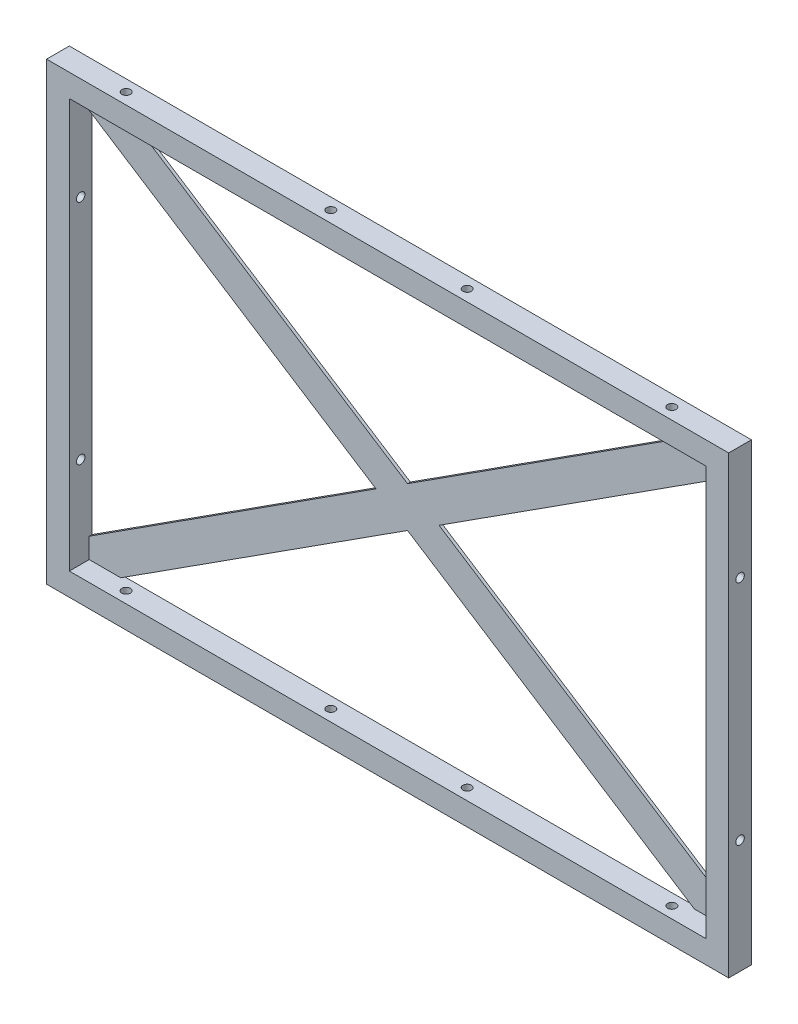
SolidWorks part; units mm, degrees
other "Outer tube"
ref_plane "Front Plane" through (0, 0, 0) normal (0, 0, 1) x (1, 0, 0)
ref_plane "Top Plane" through (0, 0, 0) normal (0, 1, 0) x (1, 0, 0)
ref_plane "Right Plane" through (0, 0, 0) normal (1, 0, 0) x (0, 0, -1)
sketch "Sketch1" plane through (0, 0, 0) normal (0, 0, 1) x (1, 0, 0)
  line L1 (355.6, -228.6) -> (-355.6, -228.6)
  line L2 (355.6, -228.6) -> (355.6, 228.6)
  line L3 (355.6, 228.6) -> (-355.6, 228.6)
  line L4 (-355.6, -228.6) -> (-355.6, 228.6)
  line L5 (355.6, -228.6) -> (-355.6, 228.6) construction
  line L6 (355.6, 228.6) -> (-355.6, -228.6) construction
  line L7 (381, -254) -> (-381, -254)
  line L8 (381, -254) -> (381, 254)
  line L9 (381, 254) -> (-381, 254)
  line L10 (-381, -254) -> (-381, 254)
  line L11 (381, -254) -> (-381, 254) construction
  line L12 (381, 254) -> (-381, -254) construction
  point P0 (0, 0)
  point P6 (0, 0)
  dimension "D1" = 25.4
  dimension "30" = 711.2
  dimension "D2" = 25.4
  dimension "9" = 457.2
extrude "Boss-Extrude1" add sketch "Sketch1" along normal blind 25.4
sketch "Sketch2" plane through (0, 0, 0) normal (0, 0, 1) x (1, 0, 0)
  line L0 (-355.6, 205.9532) -> (320.3716, -228.6)
  line L1 (-355.6, -228.6) -> (-355.6, 228.6) construction
  line L2 (355.6, -228.6) -> (-355.6, -228.6) construction
  line L3 (-320.3716, 228.6) -> (355.6, -205.9532)
  line L4 (355.6, 228.6) -> (-355.6, 228.6) construction
  line L5 (355.6, -228.6) -> (355.6, 228.6) construction
  line L6 (-355.6, -205.9532) -> (320.3716, 228.6)
  line L7 (-320.3716, -228.6) -> (355.6, 205.9532)
  line L8 (-355.6, -205.9532) -> (-355.6, -228.6)
  line L9 (355.6, 228.6) -> (-355.6, -228.6) construction
  line L10 (355.6, -228.6) -> (-355.6, 228.6) construction
  line L11 (-355.6, -228.6) -> (-320.3716, -228.6)
  line L12 (-355.6, 228.6) -> (-320.3716, 228.6)
  line L13 (-355.6, 228.6) -> (-355.6, 205.9532)
  line L14 (320.3716, 228.6) -> (355.6, 228.6)
  line L15 (355.6, 228.6) -> (355.6, 205.9532)
  line L16 (355.6, -205.9532) -> (355.6, -228.6)
  line L17 (355.6, -228.6) -> (320.3716, -228.6)
  dimension "D1" = 19.05
  dimension "D2" = 19.05
  dimension ".75" = 19.05
  dimension "D3" = 19.05
extrude "Boss-Extrude2" add sketch "Sketch2" along normal blind 3.175 separate body contours L8 L11 L7 L0 L6 | L12 L13 L0 L6 L3 | L15 L14 L6 L3 L7 | L17 L16 L3 L7 L0 | L0 L7 L3 L6
other "Intersect"
shell "Shell1" [suppressed] thickness 1.5875
hole_wizard "3/8 (0.375) Diameter Hole2" positions "Sketch9" profile "Sketch8" hole size "3/8" standard "ANSI Inch"
sketch "Sketch9" plane through (-381, 0, 0) normal (-1, 0, 0) x (0, 0, 1)
  line L0 (25.4, 254) -> (0, 254) construction
  line L2 (25.4, 254) -> (25.4, -254) construction
  point P0 (12.7, 127)
  point P3 (12.7, 254)
  dimension "D1" = 127
  dimension "D2" = 12.7
sketch "Sketch8" plane through (-381, 127, 12.7) normal (0, 1, 0) x (0, 0, 1)
  line L0 (0, 0) -> (0, 739.4606)
  line L1 (0, 739.4606) -> (4.7625, 736.599)
  line L2 (4.7625, 736.599) -> (4.7625, 0)
  line L5 (4.7625, 0) -> (0, 0)
  line L10 (0, 739.4606) -> (-4.7625, 736.599) construction
  line L11 (0, -6.35) -> (0, 107.95) construction
  dimension "Hole Dia." = 9.525
  dimension "Hole Depth" = 736.599
  dimension "Drill Angle" = 118
mirror "Mirror4" about plane through (0, 0, 0) normal (0, 1, 0) of "3/8 (0.375) Diameter Hole2"
mirror "Mirror5" about plane through (0, 0, 0) normal (1, 0, 0) of "3/8 (0.375) Diameter Hole2", "Mirror4"
hole_wizard "3/8 (0.375) Diameter Hole3" positions "Sketch11" profile "Sketch10" hole size "3/8" standard "ANSI Inch"
sketch "Sketch11" plane through (0, 254, 0) normal (0, 1, 0) x (1, 0, 0)
  line L0 (0, -13.97) -> (0, 13.97) construction
  line L3 (381, -25.4) -> (-381, -25.4) construction
  line L4 (-381, -25.4) -> (-381, 0) construction
  point P0 (-76.2, -12.7)
  point P2 (-304.8, -12.7)
  dimension "D1" = 76.2
  dimension "D2" = 12.7
  dimension "D3" = 76.2
sketch "Sketch10" plane through (-76.2, 254, 12.7) normal (1, 0, 0) x (0, 0, 1)
  line L0 (0, 0) -> (0, 485.4606)
  line L1 (0, 485.4606) -> (4.7625, 482.599)
  line L2 (4.7625, 482.599) -> (4.7625, 0)
  line L5 (4.7625, 0) -> (0, 0)
  line L10 (0, 485.4606) -> (-4.7625, 482.599) construction
  line L11 (0, -6.35) -> (0, 107.95) construction
  dimension "Hole Dia." = 9.525
  dimension "Hole Depth" = 482.599
  dimension "Drill Angle" = 118
mirror "Mirror6" about plane through (0, 0, 0) normal (1, 0, 0) of "3/8 (0.375) Diameter Hole3"
mirror "Mirror7" about plane through (0, 0, 0) normal (0, 1, 0) of "3/8 (0.375) Diameter Hole3", "Mirror6"
